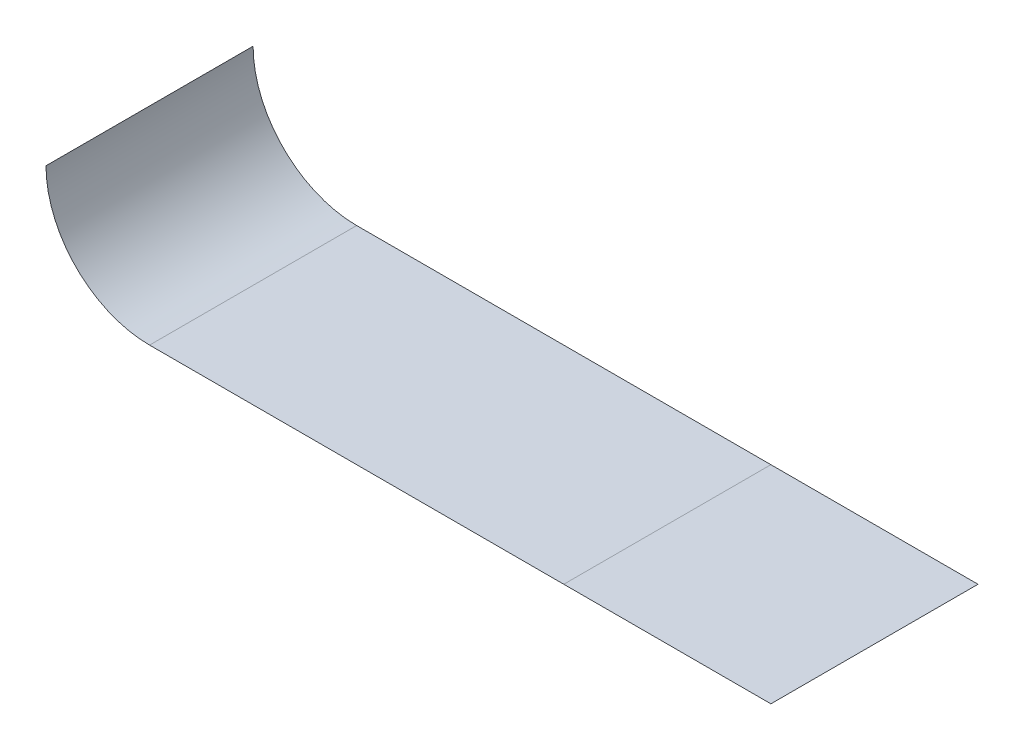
SolidWorks part; units mm, degrees
ref_plane "Front Plane" through (0, 0, 0) normal (0, 0, 1) x (1, 0, 0)
ref_plane "Top Plane" through (0, 0, 0) normal (0, 1, 0) x (1, 0, 0)
ref_plane "Right Plane" through (0, 0, 0) normal (1, 0, 0) x (0, 0, -1)
sketch "Sketch1" plane through (0, 0, 0) normal (0, 0, 1) x (1, 0, 0)
  line L0 (0, 0) -> (50.6357, 0) construction
  line L1 (0, 25) -> (-25, 25) construction
  arc A0 (0, 0) -> (-25, 25) centre (0, 25) cw
  dimension "D1" = 25
surface "Surface-Extrude1" sketch "Sketch1" parameters "D1"=50
sketch "Sketch2" plane through (0, 0, 0) normal (0, 0, 1) x (1, 0, 0)
  line L0 (0, 0) -> (100, 0)
  dimension "D1" = 100
surface "Surface-Extrude2" sketch "Sketch2" parameters "D1"=50
sketch "Sketch3" plane through (0, 0, 0) normal (0, 0, 1) x (1, 0, 0)
  line L0 (100, 0) -> (150, 0)
  dimension "D1" = 50
surface "Surface-Extrude3" sketch "Sketch3" parameters "D1"=50
